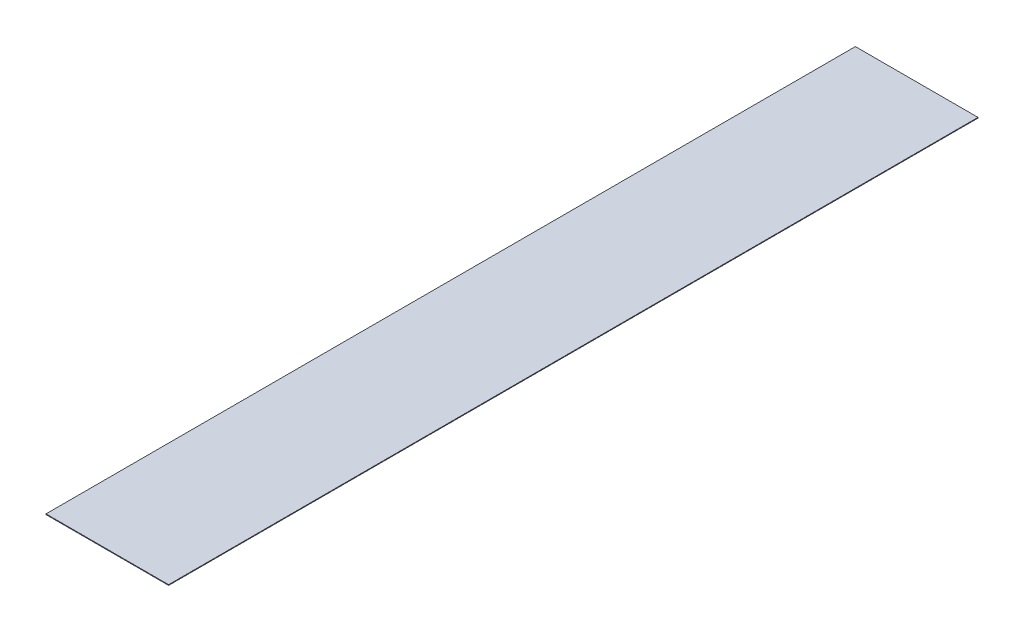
SolidWorks part; units mm, degrees
ref_plane "Front Plane" through (0, 0, 0) normal (0, 0, 1) x (1, 0, 0)
ref_plane "Top Plane" through (0, 0, 0) normal (0, 1, 0) x (1, 0, 0)
ref_plane "Right Plane" through (0, 0, 0) normal (1, 0, 0) x (0, 0, -1)
sketch "Sketch1" plane through (0, 0, 0) normal (0, 1, 0) x (1, 0, 0)
  line L5 (19.05, -76.2) -> (66.675, -76.2)
  line L6 (19.05, -76.2) -> (19.05, 238.125)
  line L7 (19.05, 238.125) -> (66.675, 238.125)
  line L8 (66.675, -76.2) -> (66.675, 238.125)
  dimension "D1" = 314.325
extrude "Boss-Extrude1" add sketch "Sketch1" along normal blind 0.254
